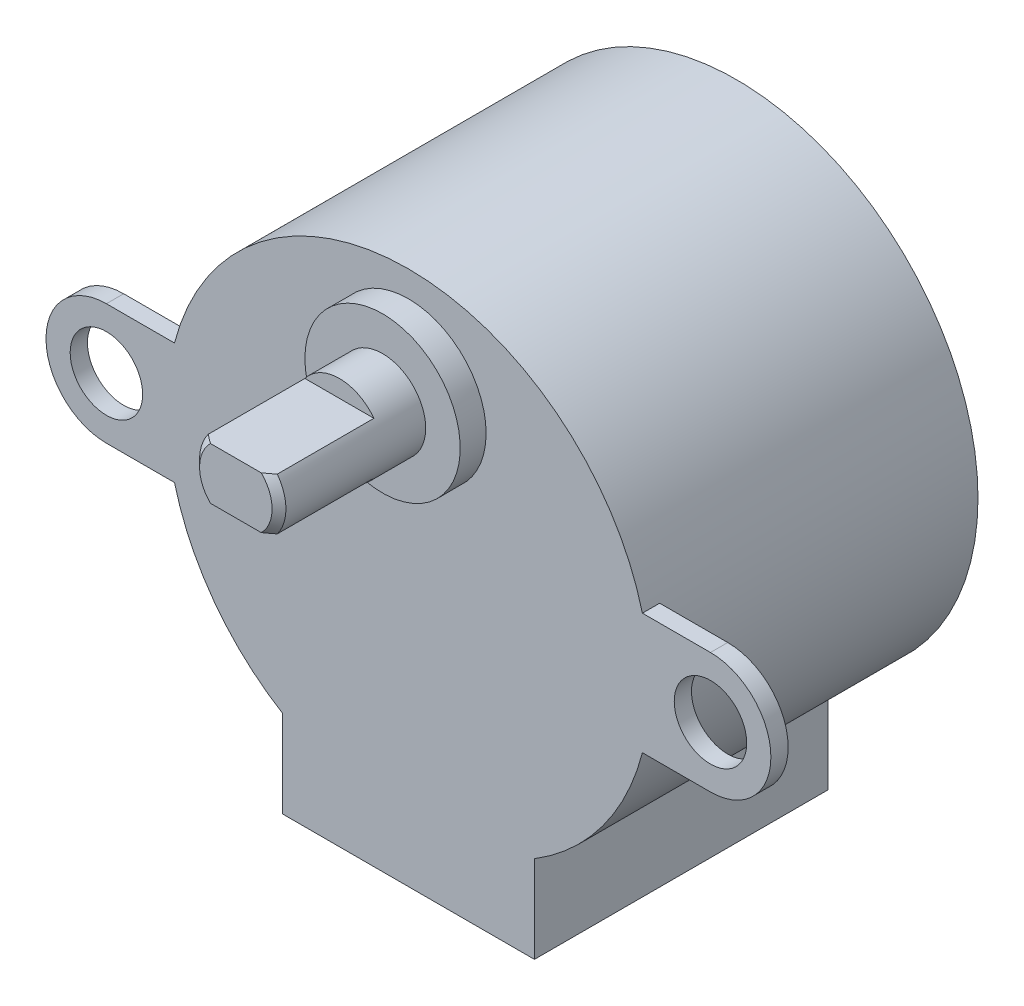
SolidWorks part; units mm, degrees
ref_plane "Piano frontale" through (0, 0, 0) normal (0, 0, 1) x (1, 0, 0)
ref_plane "Piano superiore" through (0, 0, 0) normal (0, 1, 0) x (1, 0, 0)
ref_plane "Piano destro" through (0, 0, 0) normal (1, 0, 0) x (0, 0, -1)
sketch "Schizzo1" plane through (0, 0, 0) normal (0, 0, 1) x (1, 0, 0)
  circle A0 centre (0, 0) radius 14
  dimension "D1" = 28
extrude "Estrusione-Estrusione1" add sketch "Schizzo1" along normal blind 19
sketch "Schizzo2" plane through (0, 0, 19) normal (0, 0, 1) x (1, 0, 0)
  line L0 (-22.1011, 0) -> (21.9449, 0) construction
  line L1 (13.0384, -3.5) -> (17.5, -3.5)
  line L2 (-17.5, 3.5) -> (-13.0384, 3.5)
  line L4 (-17.5, -3.5) -> (-13.0384, -3.5)
  line L6 (-17.5, 3.5) -> (17.5, -3.5) construction
  line L7 (-17.5, -3.5) -> (17.5, 3.5) construction
  line L8 (13.0384, 3.5) -> (17.5, 3.5)
  arc A0 (-13.0384, -3.5) -> (13.0384, -3.5) centre (0, 0) ccw
  arc A1 (13.0384, 3.5) -> (-13.0384, 3.5) centre (0, 0) ccw
  arc A2 (-17.5, -3.5) -> (-17.5, 3.5) centre (-17.5, 0) cw
  arc A3 (17.5, 3.5) -> (17.5, -3.5) centre (17.5, 0) cw
  dimension "D1" = 27
  dimension "D2" = 7
  dimension "D3" = 35
extrude "Estrusione-Estrusione2" add sketch "Schizzo2" against normal blind 1
sketch "Schizzo3" plane through (0, 0, 18) normal (0, 0, -1) x (-1, 0, 0)
  line L0 (-24.3952, 0) -> (28.2423, 0) construction
  circle A0 centre (-17.5, 0) radius 2.1
  circle A1 centre (17.5, 0) radius 2.1
extrude "Taglio-Estrusione1" cut sketch "Schizzo3" against normal blind 1
sketch "Schizzo4" plane through (0, 0, 18) normal (0, 0, -1) x (-1, 0, 0)
  line L0 (0, 15.4563) -> (0, -18.0814) construction
  line L2 (-7.3, -11) -> (7.3, -11)
  line L3 (-7.3, -11) -> (-7.3, -17)
  line L4 (-7.3, -17) -> (7.3, -17)
  line L5 (7.3, -11) -> (7.3, -17)
  line L6 (-7.3, -11) -> (7.3, -17) construction
  line L7 (-7.3, -17) -> (7.3, -11) construction
  arc A0 (-13.5554, -3.5) -> (13.5554, -3.5) centre (0, 0) ccw construction
  point P3 (0, -14)
  dimension "D1" = 14.6
  dimension "D2" = 17
extrude "Estrusione-Estrusione3" add sketch "Schizzo4" along normal blind 17 from offset 1
sketch "Schizzo5" plane through (0, 0, 18) normal (0, 0, -1) x (-1, 0, 0)
  circle A0 centre (0, 8) radius 4.5
  dimension "D1" = 9
  dimension "D2" = 8
extrude "Estrusione-Estrusione4" add sketch "Schizzo5" against normal blind 1.5 from offset 1
sketch "Schizzo6" plane through (0, 0, 20.5) normal (0, 0, 1) x (1, 0, 0)
  circle A0 centre (0, 8) radius 2.5
  dimension "D1" = 5
  dimension "D2" = 8
extrude "Estrusione-Estrusione5" add sketch "Schizzo6" along normal blind 8.5
sketch "Schizzo7" plane through (0, 0, 29) normal (0, 0, 1) x (1, 0, 0)
  line L0 (0, 14.8615) -> (0, 2.7318) construction
  line L2 (-2.5, 11.5) -> (2.5, 11.5)
  line L3 (-2.5, 11.5) -> (-2.5, 9.5)
  line L4 (-2.5, 9.5) -> (2.5, 9.5)
  line L5 (2.5, 11.5) -> (2.5, 9.5)
  line L6 (-2.5, 11.5) -> (2.5, 9.5) construction
  line L7 (-2.5, 9.5) -> (2.5, 11.5) construction
  line L8 (-2.5, 6.5) -> (2.5, 6.5)
  line L9 (-2.5, 6.5) -> (-2.5, 4.5)
  line L10 (-2.5, 4.5) -> (2.5, 4.5)
  line L11 (2.5, 6.5) -> (2.5, 4.5)
  line L12 (-2.5, 6.5) -> (2.5, 4.5) construction
  line L13 (-2.5, 4.5) -> (2.5, 6.5) construction
  circle A0 centre (0, 8) radius 2.5 construction
  point P3 (0, 10.5)
  point P10 (0, 5.5)
  dimension "D1" = 5
  dimension "D2" = 5
  dimension "D3" = 2
  dimension "D4" = 2
extrude "Taglio-Estrusione2" cut sketch "Schizzo7" against normal blind 6
chamfer "Smusso1" distance 0.4 angle 45 2 edges at (-2.5, 8, 29) (2.5, 8, 29)
equation "\"D2@Schizzo3\"=35/2"
